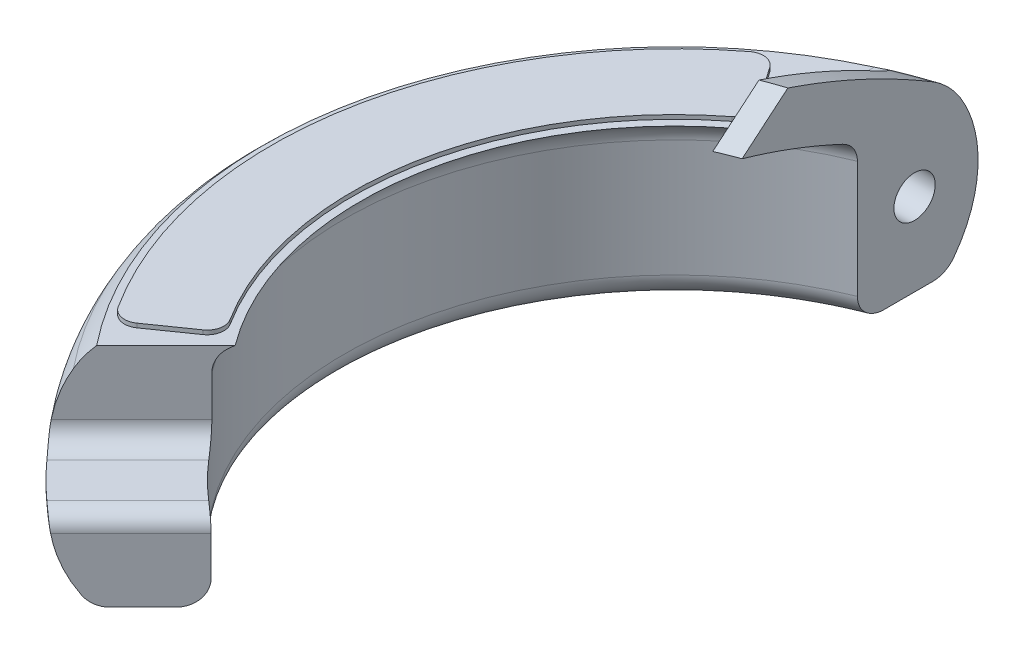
SolidWorks part; units mm, degrees
ref_plane "Спереди" through (0, 0, 0) normal (0, 0, 1) x (1, 0, 0)
ref_plane "Сверху" through (0, 0, 0) normal (0, 1, 0) x (1, 0, 0)
ref_plane "Справа" through (0, 0, 0) normal (1, 0, 0) x (0, 0, -1)
body saved out of another part "Заготовка-Дет1-1"
sketch "Эскиз1" plane through (-150, 0, 0) normal (1, 0, 0) x (0, 0, -1)
  line L0 (0, 335.8848) -> (0, -104.8275) construction
  line L1 (440, 325.7458) -> (440, -118.3462) construction
  line L2 (518.8185, 0) -> (-569.4435, 0) construction
  circle A0 centre (440, 100) radius 25
  dimension "D3" = 50
  dimension "D1" = 440
  dimension "D2" = 100
extrude "Вырез-Вытянуть1" cut sketch "Эскиз1" against normal blind 40
sketch "Эскиз2" plane through (-190, 0, 0) normal (1, 0, 0) x (0, 0, -1)
  line L0 (0, 275.0503) -> (0, -121.7259) construction
  line L1 (440, 130.1317) -> (440, 48.5858) construction
  line L3 (440, 111.547) -> (430, 105.7735)
  line L4 (430, 105.7735) -> (430, 94.2265)
  line L5 (430, 94.2265) -> (440, 88.453)
  line L6 (440, 88.453) -> (450, 94.2265)
  line L7 (450, 94.2265) -> (450, 105.7735)
  line L8 (450, 105.7735) -> (440, 111.547)
  circle A0 centre (440, 100) radius 10 construction
  circle A1 centre (440, 100) radius 15 construction
  dimension "D1" = 30
  dimension "D2" = 20
extrude "Вырез-Вытянуть2" cut sketch "Эскиз2" against normal blind 40
ref_plane "Плоскость1" through (-550, 0, 0) normal (1, 0, 0) x (0, 0, -1)
sketch "Эскиз3" plane through (-550, 0, 0) normal (1, 0, 0) x (0, 0, -1)
  line L0 (-490.8301, 0) -> (580.112, 0) construction
  circle A0 centre (440, 100) radius 45
  circle A1 centre (440, 100) radius 50
  dimension "D1" = 90
  dimension "D2" = 100
extrude "Вырез-Вытянуть3" cut sketch "Эскиз3" along normal offset from surface (319.0125 mm away) 1
